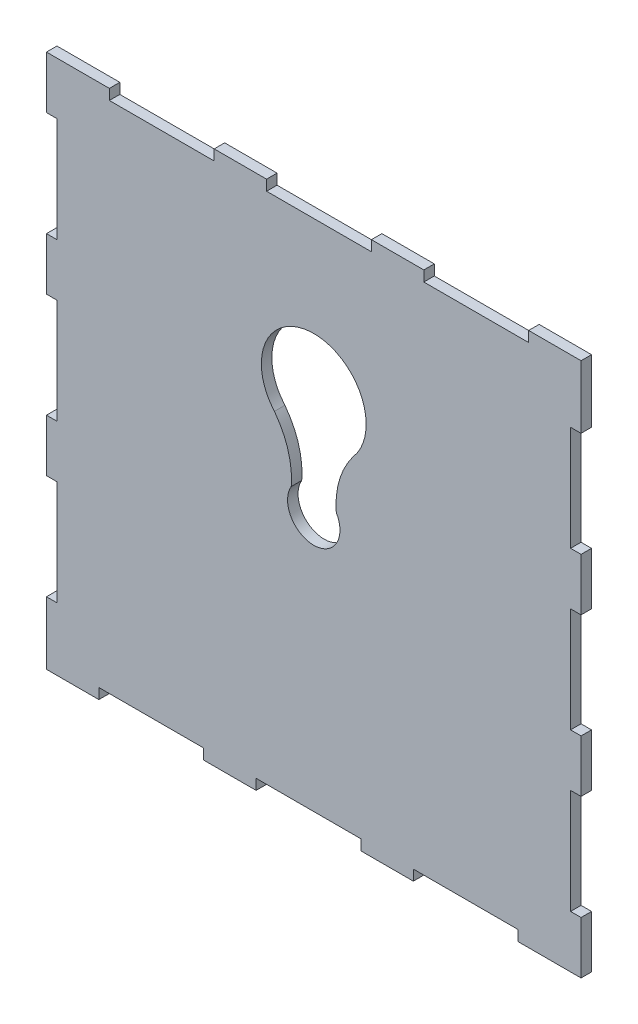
SolidWorks part; units mm, degrees
ref_plane "Front Plane" through (0, 0, 0) normal (0, 0, 1) x (1, 0, 0)
ref_plane "Top Plane" through (0, 0, 0) normal (0, 1, 0) x (1, 0, 0)
ref_plane "Right Plane" through (0, 0, 0) normal (1, 0, 0) x (0, 0, -1)
sketch "Sketch1" plane through (0, 0, 0) normal (0, 0, 1) x (1, 0, 0)
  line L0 (-52, -102) -> (-42, -102) construction
  line L1 (-52, -100) -> (-52, -102) construction
  line L2 (48, -102) -> (50, -102) construction
  line L3 (50, -102) -> (50, -92) construction
  line L4 (50, -2) -> (50, 0) construction
  line L5 (50, 0) -> (40, 0) construction
  line L6 (-40, 0) -> (-50, 0) construction
  line L7 (-50, 0) -> (-52, 0) construction
  line L8 (-52, 0) -> (-52, -10) construction
  line L9 (-52, -102) -> (-42, -102) construction
  line L10 (-52, -100) -> (-52, -102)
  line L11 (48, -102) -> (50, -102) construction
  line L12 (50, -102) -> (50, -92) construction
  line L13 (50, -2) -> (50, 0) construction
  line L14 (50, 0) -> (40, 0) construction
  line L15 (-40, 0) -> (-50, 0) construction
  line L16 (-50, 0) -> (-52, 0) construction
  line L17 (-52, 0) -> (-52, -10) construction
  line L19 (-52, 0) -> (50, 0)
  line L20 (-52, 0) -> (-52, -102)
  line L21 (-52, -102) -> (50, -102)
  line L22 (50, 0) -> (50, -102)
extrude "Boss-Extrude1" add sketch "Sketch1" against normal blind 2 contours L21 L22 L19 L20
other "Cavity1"
other "pilside<3>@pillarASSEM1"
other "pilside<1>@pillarASSEM1"
other "pilside<2>@pillarASSEM1"
other "pilside<4>@pillarASSEM1"
sketch "Sketch2" plane through (0, 0, 0) normal (0, 0, 1) x (1, 0, 0)
  line L0 (-52, 0) -> (50, -102) construction
  line L1 (50, 0) -> (-52, -102) construction
  line L2 (-1, -51) -> (-1, -20.7937) construction
  line L3 (-1, -34.0455) -> (-1, -78.9396) construction
  circle A0 centre (-1, -51) radius 5
  circle A1 centre (-1, -31) radius 10
  spline S0 degree 2 poles (7.1915, -36.7358) (2.8283, -41.974) (3.2977, -48.4446) knots 0 0 0 1 1 1
  spline S1 degree 2 poles (-9.1915, -36.7358) (-4.8283, -41.974) (-5.2977, -48.4446) knots 0 0 0 1 1 1
  point P8 (-1, -51)
  dimension "D1" = 10
  dimension "D2" = 20
  dimension "D3" = 20
  dimension "D7" = 12.666
  dimension "D4" = 4.5
  dimension "D5" = 8
  dimension "D6" = 125
extrude "Cut-Extrude1" cut sketch "Sketch2" against normal blind 2 contours A1 S1 A0 S0
equation "\"anch\" = 2"
equation "\"alt\" = 100"
equation "\"pilanch\" = 100"
equation "\"pilalt\" = 250"
equation "\"D1@Boss-Extrude1\"=\"anch\""
equation "\"D1@Cut-Extrude1\"=\"anch\""
